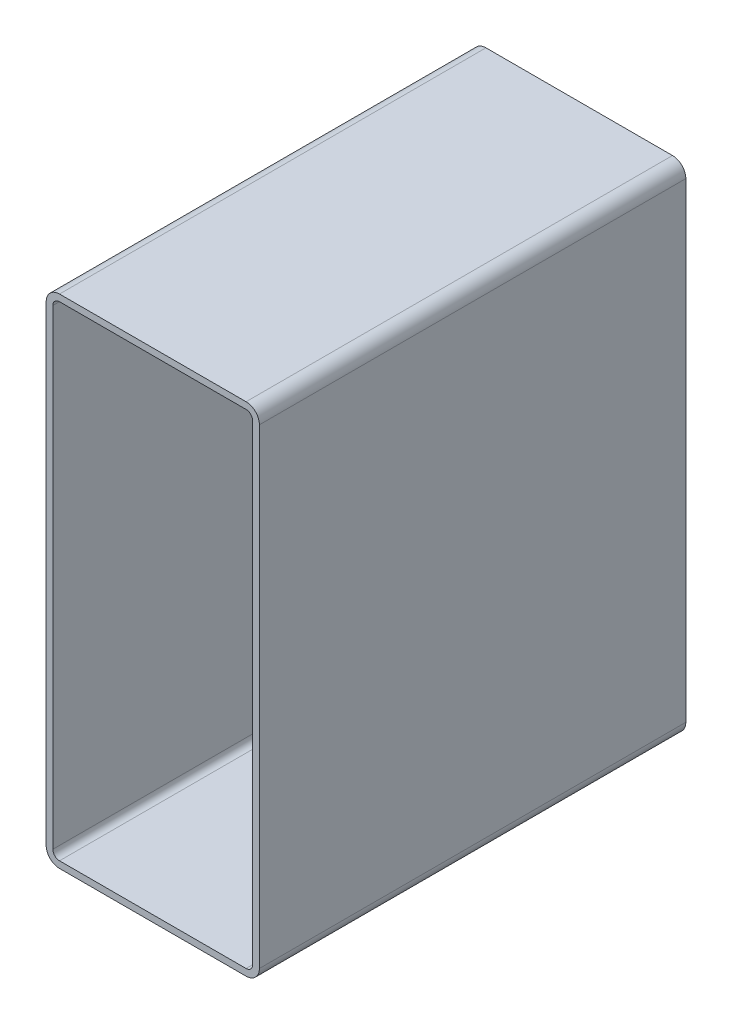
SolidWorks part; units mm, degrees
ref_plane "Front Plane" through (0, 0, 0) normal (0, 0, 1) x (1, 0, 0)
ref_plane "Top Plane" through (0, 0, 0) normal (0, 1, 0) x (1, 0, 0)
ref_plane "Right Plane" through (0, 0, 0) normal (1, 0, 0) x (0, 0, -1)
sketch "Sketch1" plane through (0, 0, 0) normal (0, 0, 1) x (1, 0, 0)
sketch_block_instance "HSS14x6x0.1875-1"
sketch_block "HSS14x6x0.1875"
extrude "Boss-Extrude1" add sketch "Sketch1" along normal blind 304.8
